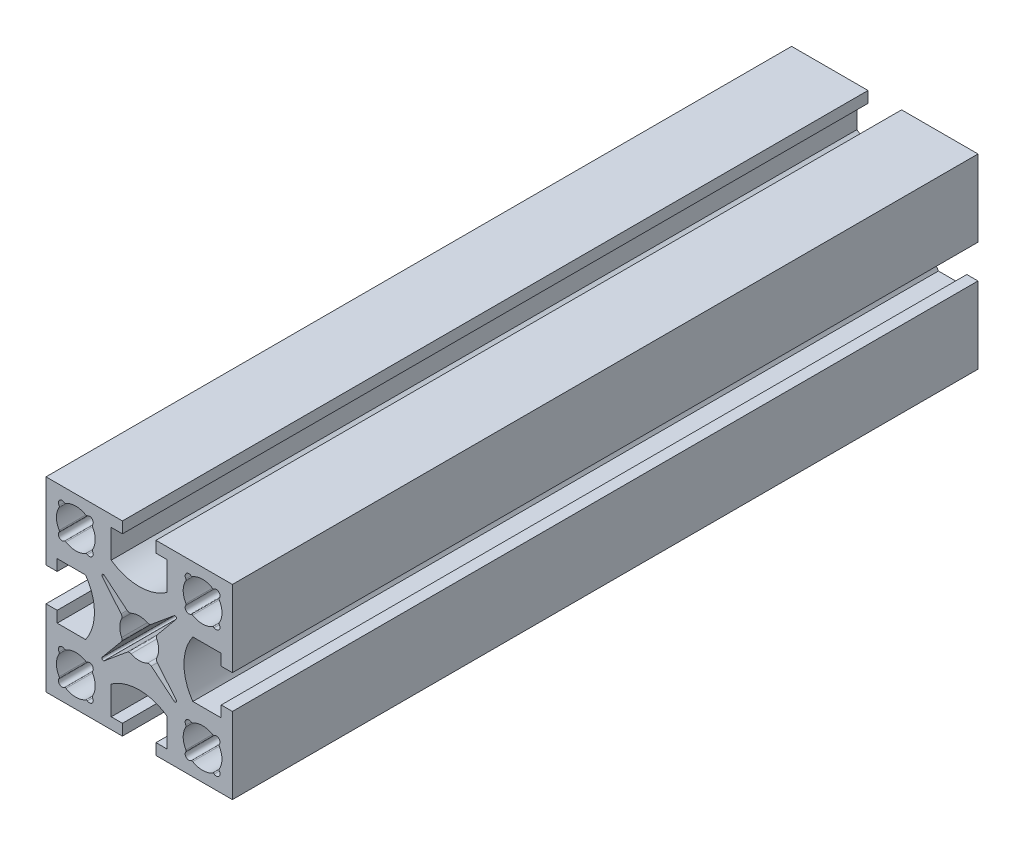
SolidWorks part; units mm, degrees
ref_plane "前基準面" through (0, 0, 0) normal (0, 0, 1) x (1, 0, 0)
ref_plane "上基準面" through (0, 0, 0) normal (0, 1, 0) x (1, 0, 0)
ref_plane "右基準面" through (0, 0, 0) normal (1, 0, 0) x (0, 0, -1)
other "質量中心"
sketch "草圖1" plane through (0, 0, 0) normal (0, 0, 1) x (1, 0, 0)
  line L0 (-28, 0) -> (0, 0) construction
  line L1 (0, 0) -> (0, 28) construction
  line L2 (-11, 3.75) -> (-7.1908, 3.75)
  line L3 (-12.5, 12.5) -> (-2.25, 12.5)
  line L4 (-2.25, 12.5) -> (-2.25, 11)
  line L5 (-2.25, 11) -> (-3.75, 11)
  line L6 (-3.75, 11) -> (-3.75, 7.1908)
  line L7 (-12.5, 12.5) -> (0, 0) construction
  line L8 (-12.5, 2.25) -> (-11, 2.25)
  line L9 (-12.5, 12.5) -> (-12.5, 2.25)
  line L10 (-11, 2.25) -> (-11, 3.75)
  line L11 (-1.6231, 2.4275) -> (-4.6807, 4.9623)
  line L13 (-2.4275, 1.6231) -> (-4.9623, 4.6807)
  line L16 (12.5, 12.5) -> (0, 0) construction
  line L19 (2.4275, 1.6231) -> (4.9623, 4.6807)
  line L20 (1.6231, 2.4275) -> (4.6807, 4.9623)
  line L21 (11, 2.25) -> (11, 3.75)
  line L22 (12.5, 12.5) -> (12.5, 2.25)
  line L23 (12.5, 2.25) -> (11, 2.25)
  line L24 (3.75, 11) -> (3.75, 7.1908)
  line L25 (2.25, 11) -> (3.75, 11)
  line L26 (2.25, 12.5) -> (2.25, 11)
  line L27 (12.5, 12.5) -> (2.25, 12.5)
  line L28 (11, 3.75) -> (7.1908, 3.75)
  line L29 (-2.4275, -1.6231) -> (-4.9623, -4.6807)
  line L30 (-1.6231, -2.4275) -> (-4.6807, -4.9623)
  line L31 (1.6231, -2.4275) -> (4.6807, -4.9623)
  line L32 (2.4275, -1.6231) -> (4.9623, -4.6807)
  line L41 (11, -2.25) -> (11, -3.75)
  line L42 (11, -3.75) -> (7.1908, -3.75)
  line L43 (12.5, -2.25) -> (11, -2.25)
  line L44 (12.5, -12.5) -> (12.5, -2.25)
  line L45 (12.5, -12.5) -> (2.25, -12.5)
  line L46 (-2.25, -11) -> (-3.75, -11)
  line L47 (2.25, -11) -> (3.75, -11)
  line L48 (2.25, -12.5) -> (2.25, -11)
  line L49 (3.75, -11) -> (3.75, -7.1908)
  line L50 (-3.75, -11) -> (-3.75, -7.1908)
  line L51 (-2.25, -12.5) -> (-2.25, -11)
  line L52 (-12.5, -12.5) -> (-2.25, -12.5)
  line L53 (-11, -2.25) -> (-11, -3.75)
  line L54 (-11, -3.75) -> (-7.1908, -3.75)
  line L55 (-12.5, -2.25) -> (-11, -2.25)
  line L56 (-12.5, -12.5) -> (-12.5, -2.25)
  arc A0 (-3.75, 7.1908) -> (3.75, 7.1908) centre (0, 12.5) ccw
  arc A1 (-10.7352, 9.8281) -> (-10.7352, 7.1719) centre (-8.5, 8.5) ccw
  arc A2 (-7.1908, 3.75) -> (-7.1908, -3.75) centre (-12.5, 0) cw
  arc A3 (-2.3588, 1.0937) -> (-2.3588, -1.0937) centre (0, 0) ccw
  arc A4 (-4.9623, 4.6807) -> (-4.9497, 4.9497) centre (-4.8083, 4.8083) cw
  arc A5 (-4.6807, 4.9623) -> (-4.9497, 4.9497) centre (-4.8083, 4.8083) ccw
  arc A6 (-2.4275, 1.6231) -> (-2.3588, 1.0937) centre (-2.8124, 1.304) cw
  arc A7 (-1.6231, 2.4275) -> (-1.0937, 2.3588) centre (-1.304, 2.8124) ccw
  arc A8 (-1.0937, 2.3588) -> (1.0937, 2.3588) centre (0, 0) cw
  arc A9 (-10.0469, 10.7447) -> (-10.7447, 10.0469) centre (-10.3385, 10.3385) ccw
  arc A10 (-6.2553, 10.0469) -> (-6.9531, 10.7447) centre (-6.6615, 10.3385) ccw
  arc A11 (-6.9531, 6.2553) -> (-6.2553, 6.9531) centre (-6.6615, 6.6615) ccw
  arc A12 (-10.7447, 6.9531) -> (-10.0469, 6.2553) centre (-10.3385, 6.6615) ccw
  arc A13 (-7.1719, 10.7352) -> (-9.8281, 10.7352) centre (-8.5, 8.5) ccw
  arc A14 (-6.2648, 7.1719) -> (-6.2648, 9.8281) centre (-8.5, 8.5) ccw
  arc A15 (-9.8281, 6.2648) -> (-7.1719, 6.2648) centre (-8.5, 8.5) ccw
  arc A16 (-10.7447, 6.9531) -> (-10.7352, 7.1719) centre (-10.9071, 7.0697) ccw
  arc A17 (-10.0469, 6.2553) -> (-9.8281, 6.2648) centre (-9.9303, 6.0929) cw
  arc A18 (-6.9531, 6.2553) -> (-7.1719, 6.2648) centre (-7.0697, 6.0929) ccw
  arc A19 (-6.2553, 6.9531) -> (-6.2648, 7.1719) centre (-6.0929, 7.0697) cw
  arc A20 (-6.2553, 10.0469) -> (-6.2648, 9.8281) centre (-6.0929, 9.9303) ccw
  arc A21 (-6.9531, 10.7447) -> (-7.1719, 10.7352) centre (-7.0697, 10.9071) cw
  arc A22 (-10.0469, 10.7447) -> (-9.8281, 10.7352) centre (-9.9303, 10.9071) ccw
  arc A23 (-10.7447, 10.0469) -> (-10.7352, 9.8281) centre (-10.9071, 9.9303) cw
  arc A24 (10.7447, 10.0469) -> (10.7352, 9.8281) centre (10.9071, 9.9303) ccw
  arc A25 (10.0469, 10.7447) -> (9.8281, 10.7352) centre (9.9303, 10.9071) cw
  arc A26 (6.9531, 10.7447) -> (7.1719, 10.7352) centre (7.0697, 10.9071) ccw
  arc A27 (6.2553, 10.0469) -> (6.2648, 9.8281) centre (6.0929, 9.9303) cw
  arc A28 (6.2553, 6.9531) -> (6.2648, 7.1719) centre (6.0929, 7.0697) ccw
  arc A29 (6.9531, 6.2553) -> (7.1719, 6.2648) centre (7.0697, 6.0929) cw
  arc A30 (10.0469, 6.2553) -> (9.8281, 6.2648) centre (9.9303, 6.0929) ccw
  arc A31 (10.7447, 6.9531) -> (10.7352, 7.1719) centre (10.9071, 7.0697) cw
  arc A32 (9.8281, 6.2648) -> (7.1719, 6.2648) centre (8.5, 8.5) cw
  arc A33 (6.2648, 7.1719) -> (6.2648, 9.8281) centre (8.5, 8.5) cw
  arc A34 (7.1719, 10.7352) -> (9.8281, 10.7352) centre (8.5, 8.5) cw
  arc A35 (10.7447, 6.9531) -> (10.0469, 6.2553) centre (10.3385, 6.6615) cw
  arc A36 (6.9531, 6.2553) -> (6.2553, 6.9531) centre (6.6615, 6.6615) cw
  arc A37 (6.2553, 10.0469) -> (6.9531, 10.7447) centre (6.6615, 10.3385) cw
  arc A38 (10.0469, 10.7447) -> (10.7447, 10.0469) centre (10.3385, 10.3385) cw
  arc A39 (-1.0937, -2.3588) -> (1.0937, -2.3588) centre (0, 0) ccw
  arc A40 (1.6231, 2.4275) -> (1.0937, 2.3588) centre (1.304, 2.8124) cw
  arc A41 (2.4275, 1.6231) -> (2.3588, 1.0937) centre (2.8124, 1.304) ccw
  arc A42 (4.6807, 4.9623) -> (4.9497, 4.9497) centre (4.8083, 4.8083) cw
  arc A43 (4.9623, 4.6807) -> (4.9497, 4.9497) centre (4.8083, 4.8083) ccw
  arc A44 (7.1908, 3.75) -> (7.1908, -3.75) centre (12.5, 0) ccw
  arc A45 (10.7352, 9.8281) -> (10.7352, 7.1719) centre (8.5, 8.5) cw
  circle A46 centre (-8.5, 8.5) radius 2.6 construction
  arc A47 (-10.7447, -10.0469) -> (-10.7352, -9.8281) centre (-10.9071, -9.9303) ccw
  arc A48 (-10.0469, -10.7447) -> (-9.8281, -10.7352) centre (-9.9303, -10.9071) cw
  arc A49 (-6.9531, -10.7447) -> (-7.1719, -10.7352) centre (-7.0697, -10.9071) ccw
  arc A50 (-6.2553, -10.0469) -> (-6.2648, -9.8281) centre (-6.0929, -9.9303) cw
  arc A51 (-6.2553, -6.9531) -> (-6.2648, -7.1719) centre (-6.0929, -7.0697) ccw
  arc A52 (-6.9531, -6.2553) -> (-7.1719, -6.2648) centre (-7.0697, -6.0929) cw
  arc A53 (-10.0469, -6.2553) -> (-9.8281, -6.2648) centre (-9.9303, -6.0929) ccw
  arc A54 (-10.7447, -6.9531) -> (-10.7352, -7.1719) centre (-10.9071, -7.0697) cw
  arc A55 (-9.8281, -6.2648) -> (-7.1719, -6.2648) centre (-8.5, -8.5) cw
  arc A56 (-6.2648, -7.1719) -> (-6.2648, -9.8281) centre (-8.5, -8.5) cw
  arc A57 (-7.1719, -10.7352) -> (-9.8281, -10.7352) centre (-8.5, -8.5) cw
  arc A58 (-10.7447, -6.9531) -> (-10.0469, -6.2553) centre (-10.3385, -6.6615) cw
  arc A59 (-6.9531, -6.2553) -> (-6.2553, -6.9531) centre (-6.6615, -6.6615) cw
  arc A60 (-6.2553, -10.0469) -> (-6.9531, -10.7447) centre (-6.6615, -10.3385) cw
  arc A61 (-10.0469, -10.7447) -> (-10.7447, -10.0469) centre (-10.3385, -10.3385) cw
  arc A62 (-10.7352, -9.8281) -> (-10.7352, -7.1719) centre (-8.5, -8.5) cw
  arc A63 (-1.6231, -2.4275) -> (-1.0937, -2.3588) centre (-1.304, -2.8124) cw
  arc A64 (-2.4275, -1.6231) -> (-2.3588, -1.0937) centre (-2.8124, -1.304) ccw
  arc A65 (-4.6807, -4.9623) -> (-4.9497, -4.9497) centre (-4.8083, -4.8083) cw
  arc A66 (-4.9623, -4.6807) -> (-4.9497, -4.9497) centre (-4.8083, -4.8083) ccw
  arc A67 (-3.75, -7.1908) -> (3.75, -7.1908) centre (0, -12.5) cw
  arc A69 (4.9623, -4.6807) -> (4.9497, -4.9497) centre (4.8083, -4.8083) cw
  arc A70 (4.6807, -4.9623) -> (4.9497, -4.9497) centre (4.8083, -4.8083) ccw
  arc A71 (2.4275, -1.6231) -> (2.3588, -1.0937) centre (2.8124, -1.304) cw
  arc A72 (1.6231, -2.4275) -> (1.0937, -2.3588) centre (1.304, -2.8124) ccw
  arc A73 (10.7352, -9.8281) -> (10.7352, -7.1719) centre (8.5, -8.5) ccw
  arc A74 (10.0469, -10.7447) -> (10.7447, -10.0469) centre (10.3385, -10.3385) ccw
  arc A75 (6.2553, -10.0469) -> (6.9531, -10.7447) centre (6.6615, -10.3385) ccw
  arc A76 (6.9531, -6.2553) -> (6.2553, -6.9531) centre (6.6615, -6.6615) ccw
  arc A77 (10.7447, -6.9531) -> (10.0469, -6.2553) centre (10.3385, -6.6615) ccw
  arc A78 (7.1719, -10.7352) -> (9.8281, -10.7352) centre (8.5, -8.5) ccw
  arc A79 (6.2648, -7.1719) -> (6.2648, -9.8281) centre (8.5, -8.5) ccw
  arc A80 (9.8281, -6.2648) -> (7.1719, -6.2648) centre (8.5, -8.5) ccw
  arc A81 (10.7447, -6.9531) -> (10.7352, -7.1719) centre (10.9071, -7.0697) ccw
  arc A82 (10.0469, -6.2553) -> (9.8281, -6.2648) centre (9.9303, -6.0929) cw
  arc A83 (6.9531, -6.2553) -> (7.1719, -6.2648) centre (7.0697, -6.0929) ccw
  arc A84 (6.2553, -6.9531) -> (6.2648, -7.1719) centre (6.0929, -7.0697) cw
  arc A85 (6.2553, -10.0469) -> (6.2648, -9.8281) centre (6.0929, -9.9303) ccw
  arc A86 (6.9531, -10.7447) -> (7.1719, -10.7352) centre (7.0697, -10.9071) cw
  arc A87 (10.0469, -10.7447) -> (9.8281, -10.7352) centre (9.9303, -10.9071) ccw
  arc A88 (10.7447, -10.0469) -> (10.7352, -9.8281) centre (10.9071, -9.9303) cw
  arc A91 (2.3588, -1.0937) -> (2.3588, 1.0937) centre (0, 0) ccw
  point P26 (-5.0912, 4.8083)
  point P29 (-4.8083, 5.0912)
  point P32 (-2.2131, 1.3646)
  point P35 (-1.3646, 2.2131)
  point P50 (-8.5, 8.5)
  point P121 (1.3646, 2.2131)
  point P122 (2.2131, 1.3646)
  point P123 (4.8083, 5.0912)
  point P124 (5.0912, 4.8083)
  point P164 (-1.3646, -2.2131)
  point P165 (-2.2131, -1.3646)
  point P166 (-4.8083, -5.0912)
  point P167 (-5.0912, -4.8083)
  point P185 (5.0912, -4.8083)
  point P186 (4.8083, -5.0912)
  point P187 (2.2131, -1.3646)
  point P188 (1.3646, -2.2131)
  dimension "D1" = 28
  dimension "D3" = 7.5
  dimension "D2" = 4.5
  dimension "D9" = 5.2
  dimension "D11" = 2.6
  dimension "D12" = 6.8
  dimension "D5" = 25
  dimension "D7" = 6.5
  dimension "D15" = 0.2
  dimension "D16" = 0.5
  dimension "D20" = 0.5
  dimension "D14" = 0.2
  dimension "D4" = 25
  dimension "D6" = 1.5
  dimension "D8" = 0
  dimension "D13" = 0.6
  dimension "D10" = 17
  dimension "D21" = 2.6
  dimension "D22" = 4
extrude "填料-伸長1" add sketch "草圖1" along normal mid plane 100
